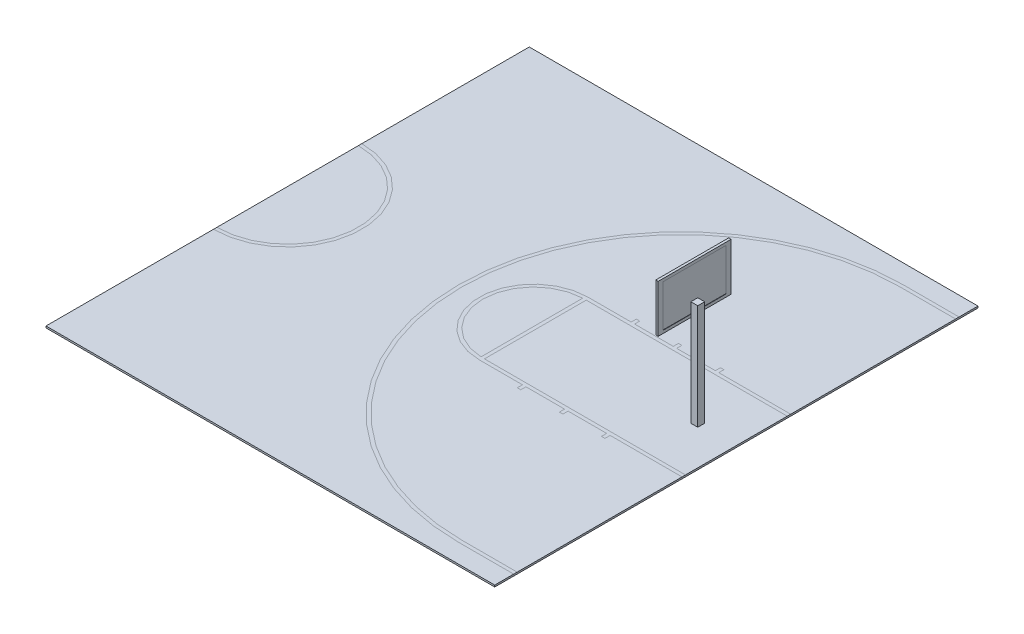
SolidWorks part; units mm, degrees
ref_plane "Front Plane" through (0, 0, 0) normal (0, 0, 1) x (1, 0, 0)
ref_plane "Top Plane" through (0, 0, 0) normal (0, 1, 0) x (1, 0, 0)
ref_plane "Right Plane" through (0, 0, 0) normal (1, 0, 0) x (0, 0, -1)
sketch "Sketch1" plane through (0, 0, 0) normal (0, 1, 0) x (1, 0, 0)
  line L1 (-6500, 7000) -> (6500, 7000)
  line L2 (-6500, 7000) -> (-6500, -7000)
  line L3 (-6500, -7000) -> (6500, -7000)
  line L4 (6500, 7000) -> (6500, -7000)
  line L5 (-6500, 7000) -> (6500, -7000) construction
  line L6 (-6500, -7000) -> (6500, 7000) construction
  point P0 (0, 0)
  dimension "D1" = 13000
  dimension "D2" = 14000
extrude "Boss-Extrude1" add sketch "Sketch1" along normal blind 50
sketch "Sketch2" plane through (0, 50, 0) normal (0, 1, 0) x (1, 0, 0)
  line L0 (6500, 0) -> (5280.8, 0) construction
  line L1 (6500, -7000) -> (6500, 7000) construction
  line L3 (5280.8, 100) -> (5480.8, 100)
  line L4 (5280.8, 100) -> (5280.8, -100)
  line L5 (5280.8, -100) -> (5480.8, -100)
  line L6 (5480.8, 100) -> (5480.8, -100)
  line L7 (5280.8, 100) -> (5480.8, -100) construction
  line L8 (5280.8, -100) -> (5480.8, 100) construction
  point P5 (5380.8, 0)
  dimension "D1" = 1219.2
  dimension "D2" = 200
  dimension "D3" = 200
extrude "Boss-Extrude2" add sketch "Sketch2" along normal blind 3048
sketch "Sketch3" plane through (5280.8, 0, 0) normal (-1, 0, 0) x (0, 0, 1)
  line L0 (100, 3098) -> (100, 50) construction
  line L5 (-100, 3098) -> (100, 3098)
  line L6 (-100, 3098) -> (-100, 2998)
  line L7 (-100, 2998) -> (100, 2998)
  line L8 (100, 3098) -> (100, 2998)
  dimension "D1" = 100
extrude "Boss-Extrude3" add sketch "Sketch3" along normal blind 200
ref_plane "Plane1" through (0, 0, 0) normal (0, 0, -1) x (-1, 0, 0)
sketch "Sketch4" plane through (0, 0, 0) normal (0, 0, -1) x (-1, 0, 0)
  line L1 (-4843.7, 3169.3115) -> (-4843.7, 2770.5757) construction
  line L3 (-5080.8, 2998) -> (-5080.8, 3098) construction
  line L4 (-5080.8, 3098) -> (-5480.8, 3098) construction
  circle A1 centre (-5080.8, 3089.5) radius 8.5
  dimension "D1" = 17
  dimension "D2" = 237.1
revolve "Revolve1" add sketch "Sketch4" angle 360 about L1
sketch "Sketch5" plane through (0, 0, 0) normal (0, 0, -1) x (-1, 0, 0)
  line L0 (-5080.8, 2998) -> (-5080.8, 3098) construction
  line L7 (-4843.7, 3131.5104) -> (-4843.7, 2953.2417) construction
  line L9 (-4606.6, 3098) -> (-5080.8, 3098) construction
  line L10 (-5085.05, 3085.2743) -> (-5076.55, 3085.2743)
  line L11 (-5085.05, 3085.2743) -> (-5085.05, 3035.2743)
  line L12 (-5085.05, 3035.2743) -> (-5076.55, 3035.2743)
  line L13 (-5076.55, 3085.2743) -> (-5076.55, 3035.2743)
  line L14 (-5085.05, 3085.2743) -> (-5076.55, 3035.2743) construction
  line L15 (-5085.05, 3035.2743) -> (-5076.55, 3085.2743) construction
  point P0 (-5080.8, 3060.2743)
  point P9 (-5080.8, 3098)
  point P11 (-5130.8, 3098)
  point P12 (-5080.8, 3098)
  point P14 (-5080.8, 3098)
  point P15 (-5080.8, 3098)
  point P16 (-5080.8, 3098)
  point P17 (-5080.8, 3098)
  point P18 (-5080.8, 3098)
  point P19 (-5080.8, 3098)
  point P20 (-5080.8, 3098)
  dimension "D1" = 50
  dimension "D2" = 8.5
  dimension "D3" = 237.1
revolve "Revolve2" add sketch "Sketch5" angle 210 mid plane about L7
ref_plane "Plane2" through (5280.8, 0, 0) normal (-1, 0, 0) x (0, 0, 1)
sketch "Sketch6" plane through (5280.8, 0, 0) normal (-1, 0, 0) x (0, 0, 1)
  line L0 (-100, 2998) -> (100, 2998) construction
  line L5 (-543.9298, 3098) -> (543.9298, 3098) construction
  line L6 (0, 3482.311) -> (0, 2713.689) construction
  line L8 (-914.4, 4012.4) -> (914.4, 4012.4)
  line L9 (-914.4, 4012.4) -> (-914.4, 2793.2)
  line L10 (-914.4, 2793.2) -> (914.4, 2793.2)
  line L11 (914.4, 4012.4) -> (914.4, 2793.2)
  line L12 (-914.4, 4012.4) -> (914.4, 2793.2) construction
  line L13 (-914.4, 2793.2) -> (914.4, 4012.4) construction
  point P0 (0, 2998)
  point P1 (0, 3402.8)
  point P8 (0, 3098)
  point P9 (0, 3098)
  dimension "D1" = 1828.8
  dimension "D2" = 1219.2
  dimension "D3" = 304.8
extrude "Boss-Extrude4" add sketch "Sketch6" along normal blind 50
sketch "Sketch7" plane through (0, 0, 0) normal (0, 0, -1) x (-1, 0, 0)
  line L0 (-5080.8, 2998) -> (-5230.8, 2998)
  line L1 (-5230.8, 2998) -> (-5230.8, 2907.1258)
  line L2 (-5230.8, 2793.2) -> (-5230.8, 4012.4) construction
  line L3 (-5230.8, 2907.1258) -> (-5080.8, 2998)
extrude "Boss-Extrude5" add sketch "Sketch7" along normal mid plane 200
sketch "Sketch10" plane through (0, 50, 0) normal (0, 1, 0) x (1, 0, 0)
  line L1 (576.5, -1523.1796) -> (576.5, -1524)
  line L5 (1978, 1574) -> (1978, 1724)
  line L6 (3197.2, 1574) -> (3197.2, 1724)
  line L7 (1978, -1574) -> (3097.2, -1574)
  line L8 (3197.2, 1574) -> (4316.4, 1574)
  line L9 (1978, 1574) -> (3097.2, 1574)
  line L10 (1878, 1724) -> (1978, 1724)
  line L11 (4416.4, -1574) -> (6500, -1574)
  line L12 (3197.2, -1574) -> (4316.4, -1574)
  line L13 (4893.7, 6450.8) -> (6500, 6450.8)
  line L14 (4893.7, -6450.8) -> (6500, -6450.8)
  line L16 (676.5, 1474) -> (6500, 1474)
  line L17 (626.5, -1574) -> (1878, -1574)
  line L18 (576.5, 1524) -> (576.5, 1523.1796)
  line L19 (4893.7, 6350.8) -> (6500, 6350.8)
  line L20 (4893.7, -6350.8) -> (6500, -6350.8)
  line L21 (626.5, 1574) -> (1878, 1574)
  line L22 (676.5, -1474) -> (6500, -1474)
  line L23 (676.5, 1474) -> (676.5, -1474)
  line L24 (4416.4, 1574) -> (4416.4, 1724)
  line L25 (576.5, 1473.1517) -> (576.5, -1473.1517)
  line L26 (1878, -1574) -> (1878, -1724)
  line L27 (3097.2, -1574) -> (3097.2, -1724)
  line L28 (4316.4, -1574) -> (4316.4, -1724)
  line L29 (1878, 1574) -> (1878, 1724)
  line L30 (3097.2, 1574) -> (3097.2, 1724)
  line L31 (4316.4, 1574) -> (4316.4, 1724)
  line L32 (1978, -1574) -> (1978, -1724)
  line L33 (3197.2, -1574) -> (3197.2, -1724)
  line L34 (4416.4, -1574) -> (4416.4, -1724)
  line L35 (4416.4, 1574) -> (6500, 1574)
  line L36 (3097.2, 1724) -> (3197.2, 1724)
  line L37 (4316.4, 1724) -> (4416.4, 1724)
  line L38 (1878, -1724) -> (1978, -1724)
  line L39 (3097.2, -1724) -> (3197.2, -1724)
  line L40 (4316.4, -1724) -> (4416.4, -1724)
  arc A4 (-6500, 2050) -> (-6500, -2050) centre (-6500, 0) cw
  arc A5 (4893.7, 6450.8) -> (4893.7, -6450.8) centre (4893.7, 0) ccw
  arc A6 (626.5, 1574) -> (626.5, -1574) centre (626.5, 0) ccw
  arc A7 (-6500, 2150) -> (-6500, -2150) centre (-6500, 0) cw
  arc A8 (4893.7, 6350.8) -> (4893.7, -6350.8) centre (4893.7, 0) ccw
  arc A9 (576.5, 1473.1517) -> (576.5, -1473.1517) centre (626.5, 0) ccw
  point P0 (4893.7, 0)
  point P4 (626.5, 0)
  point P5 (626.5, -1524)
  point P6 (4893.7, 6400.8)
  point P10 (4893.7, -6400.8)
  point P12 (626.5, 1524)
  point P13 (626.5, 0)
  point P14 (6500, -1524)
  point P15 (6500, 1524)
  point P18 (3147.2, 1524)
  point P19 (3147.2, 1724)
  point P20 (1928, 1524)
  point P21 (1928, 1724)
  point P24 (4366.4, -1524)
  point P25 (4366.4, -1724)
  point P26 (3147.2, -1524)
  point P27 (3147.2, -1724)
  point P28 (1928, -1524)
  point P29 (1928, -1724)
  point P48 (3197.2, 1524)
  point P61 (626.5, -1474)
  point P66 (1878, -1524)
  point P71 (4316.4, -1524)
  point P75 (3097.2, 1524)
  point P79 (1978, -1524)
  point P83 (4416.4, -1524)
  dimension "D3" = 3048
chamfer "Chamfer1" distance 40 angle 60 2 edges at (4782.334, 3035.2743, 229.021) (4782.334, 3035.2743, -229.021)
ref_plane "Plane3" through (5255.8, 0, 0) normal (-1, 0, 0) x (0, 0, 1)
sketch "Sketch12" plane through (5255.8, 0, 0) normal (-1, 0, 0) x (0, 0, 1)
  line L5 (-914.4, 4012.4) -> (914.4, 4012.4)
  line L6 (-914.4, 4012.4) -> (-914.4, 2793.2)
  line L7 (-914.4, 2793.2) -> (914.4, 2793.2)
  line L8 (914.4, 4012.4) -> (914.4, 2793.2)
  line L9 (1056.3487, 2712.9921) -> (-1056.3487, 2712.9921)
  line L10 (1056.3487, 2712.9921) -> (1056.3487, 4092.6079)
  line L11 (1056.3487, 4092.6079) -> (-1056.3487, 4092.6079)
  line L12 (-1056.3487, 2712.9921) -> (-1056.3487, 4092.6079)
  line L13 (1056.3487, 2712.9921) -> (-1056.3487, 4092.6079) construction
  line L14 (1056.3487, 4092.6079) -> (-1056.3487, 2712.9921) construction
  point P4 (0, 3402.8)
extrude "Boss-Extrude7" add sketch "Sketch12" along normal mid plane 70
sketch "Sketch13" plane through (5255.8, 0, 0) normal (-1, 0, 0) x (0, 0, 1)
  line L5 (-303.506, 3495.5245) -> (303.506, 3495.5245)
  line L6 (-303.506, 3495.5245) -> (-303.506, 3103.3169)
  line L7 (-303.506, 3103.3169) -> (303.506, 3103.3169)
  line L8 (303.506, 3495.5245) -> (303.506, 3103.3169)
  line L11 (-354.5249, 3529.0056) -> (354.5249, 3529.0056)
  line L12 (-354.5249, 3529.0056) -> (-354.5249, 3069.8358)
  line L13 (-354.5249, 3069.8358) -> (354.5249, 3069.8358)
  line L14 (354.5249, 3529.0056) -> (354.5249, 3069.8358)
  point P0 (0, 3299.4207)
  point P5 (0, 3299.4207)
ref_plane "Plane4" through (0, 3108, 0) normal (0, 1, 0) x (1, 0, 0)
sketch "Point1" plane through (0, 3108, 0) normal (0, 1, 0) x (1, 0, 0)
  point P0 (4843.7, 0)
sketch "Sketch14" plane through (0, 50, 0) normal (0, 1, 0) x (1, 0, 0)
  line L0 (-853.3034, -6306.4369) -> (-479.3034, -6306.4369) construction
sketch "Sketch16" plane through (0, 50, 0) normal (0, 1, 0) x (1, 0, 0)
  line L0 (760.1738, 206.2152) -> (760.1738, 72.8819) construction
ref_plane "SensorPlane" through (0, 3025, 0) normal (0, 1, 0) x (1, 0, 0)
sketch "Point" plane through (0, 3025, 0) normal (0, 1, 0) x (1, 0, 0)
  point P0 (4843.7, 0)
sketch "Sketch18" plane through (0, 50, 0) normal (0, 1, 0) x (1, 0, 0)
  line L0 (324.6493, 0) -> (0, 0) construction
  line L1 (0, 0) -> (0, -324.4094) construction
